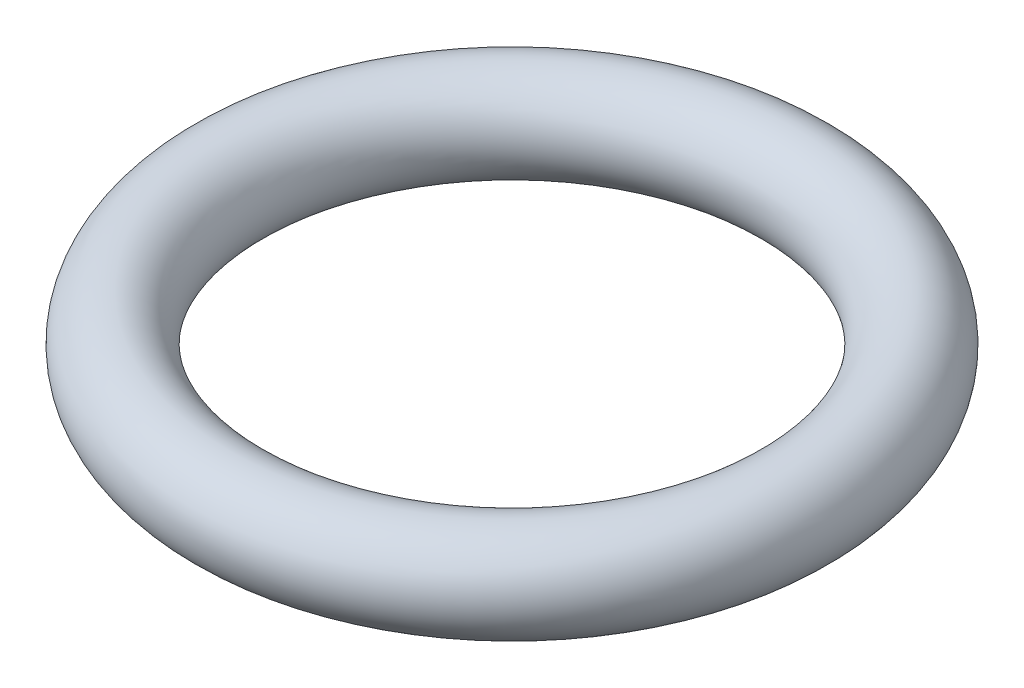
SolidWorks part; units mm, degrees
ref_plane "Plan de face" through (0, 0, 0) normal (0, 0, 1) x (1, 0, 0)
ref_plane "Plan de dessus" through (0, 0, 0) normal (0, 1, 0) x (1, 0, 0)
ref_plane "Plan de droite" through (0, 0, 0) normal (1, 0, 0) x (0, 0, -1)
sketch "Esquisse1" plane through (0, 0, 0) normal (0, 0, 1) x (1, 0, 0)
  line L0 (0, 0) -> (0, 44.6602) construction
  circle A0 centre (-6, 0) radius 1
  dimension "D1" = 2
  dimension "D2" = 12
revolve "Révolution1" add sketch "Esquisse1" angle 360 about L0
